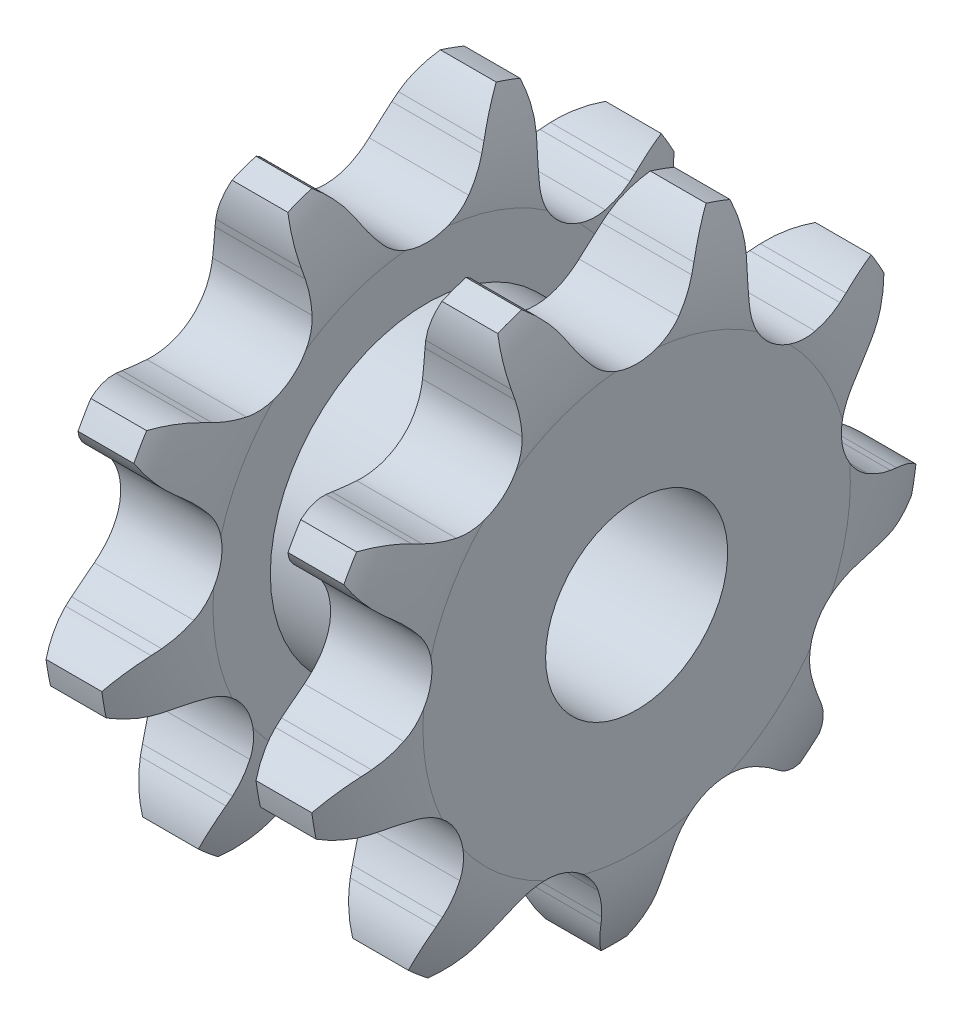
SolidWorks part; units mm, degrees
ref_plane "Plane1" through (0, 0, 0) normal (0, 0, 1) x (1, 0, 0)
ref_plane "Plane2" through (0, 0, 0) normal (0, 1, 0) x (1, 0, 0)
ref_plane "Plane3" through (0, 0, 0) normal (1, 0, 0) x (0, 0, -1)
sketch "Clipboard" plane through (0, 0, 0) normal (0, 1, 0) x (1, 0, 0)
  line L0 (0, 0) -> (25.0873, -3.9734)
  line L1 (-15, 0) -> (100, 0) construction
  line L2 (0, 0) -> (-2.1039, 2.3779)
  line L3 (0, 0) -> (-11.863, 4.5341)
  line L4 (0, 0) -> (15.6796, 2.4834)
  line L5 (0, 0) -> (-47.5972, -17.7524)
  line L6 (0, 0) -> (-35.9946, -24.2857)
  line L7 (-2.1039, 2.3779) -> (47.7628, 12.071)
  line L8 (-76.2, 38.1) -> (-47.9044, 38.1)
  line L9 (-73.2054, 38.5461) -> (-73.0531, 38.5485)
  line L10 (-73.0533, 76.1892) -> (-43.7671, 76.1892)
  circle A0 centre (0, 0) radius 7.9375
  circle A1 centre (0, 0) radius 21.812
  circle A2 centre (0, 0) radius 25.4
sketch "BasProSke" plane through (0, 0, 0) normal (0, 1, 0) x (1, 0, 0)
  line L0 (-10, 0) -> (60, 0) construction
  line L1 (0, 0) -> (0, 29.813)
  line L2 (0, 0) -> (43.4213, 0)
  line L3 (43.4213, 0) -> (43.4213, 29.813)
  line L4 (40.2463, 42.513) -> (3.175, 42.513)
  arc A0 (0, 29.813) -> (3.175, 42.513) centre (26.9875, 29.813) cw
  arc A1 (43.4213, 29.813) -> (40.2463, 42.513) centre (16.4338, 29.813) ccw
revolve "Base-Revolve" add sketch "BasProSke" angle 360 about L0
sketch "GrvSke" plane through (0, 0, 0) normal (0, 1, 0) x (1, 0, 0)
  line L0 (14.1351, 29.813) -> (14.1351, 21.812)
  line L1 (14.1351, 21.812) -> (29.2862, 21.812)
  line L2 (29.2862, 21.812) -> (29.2862, 29.813)
  line L3 (10.9601, 42.513) -> (32.4612, 42.513)
  line L4 (21.7106, 0) -> (21.7106, 52.07) construction
  line L5 (-10, 0) -> (60, 0) construction
  line L6 (0, 0) -> (35.56, 0) construction
  arc A0 (29.2862, 29.813) -> (32.4612, 42.513) centre (56.2737, 29.813) cw
  arc A1 (14.1351, 29.813) -> (10.9601, 42.513) centre (-12.8524, 29.813) ccw
revolve "Groove" cut sketch "GrvSke" angle 360 about L6
pattern_linear "Grooves" [suppressed]
sketch "TooCutSke" plane through (0, 0, 0) normal (1, 0, 0) x (0, 0, -1)
  line L0 (8.4728, 35.2524) -> (9.083, 36.3141)
  line L1 (0, 0) -> (0, 107) construction
  line L2 (0, 37.1323) -> (-10, 37.1323) construction
  line L3 (-8.4728, 35.2524) -> (-9.083, 36.3141)
  arc A0 (5.9876, 31.8038) -> (8.4728, 35.2524) centre (-9.4872, 45.5752) ccw
  arc A1 (5.9876, 31.8038) -> (-5.9876, 31.8038) centre (0, 37.1323) cw
  arc A2 (9.083, 36.3141) -> (20.8847, 43.143) centre (20.8847, 29.5309) cw
  arc A3 (-5.9876, 31.8038) -> (-8.4728, 35.2524) centre (9.4872, 45.5752) cw
  arc A4 (-9.083, 36.3141) -> (-20.8847, 43.143) centre (-20.8847, 29.5309) ccw
  arc A5 (20.8847, 43.143) -> (-20.8847, 43.143) centre (0, 0) ccw
extrude "ToothCut" cut sketch "TooCutSke" along normal through all
pattern_circular "TeethCuts" count 9 every 40 about axis through (-10, 0, 0) along (1, 0, 0) of "ToothCut"
sketch "HubNeaOneSke" plane through (0, 0, 0) normal (-1, 0, 0) x (0, 0, 1)
  circle A0 centre (0, 0) radius 21.812
extrude "HubNearOne" [suppressed] add sketch "HubNeaOneSke" along normal blind 7.3788
sketch "HubNeaBotSke" plane through (0, 0, 0) normal (-1, 0, 0) x (0, 0, 1)
  circle A0 centre (0, 0) radius 21.812
extrude "HubNearBoth" [suppressed] add sketch "HubNeaBotSke" along normal blind 3.6894
ref_plane "FarPln" through (43.4213, 0, 0) normal (1, 0, 0) x (0, 0, -1)
sketch "HubFarSke" plane through (43.4213, 0, 0) normal (1, 0, 0) x (0, 0, -1)
  circle A0 centre (0, 0) radius 21.812
extrude "HubFar" [suppressed] add sketch "HubFarSke" along normal blind 3.6894
sketch "BorSke" plane through (0, 0, 0) normal (1, 0, 0) x (0, 0, -1)
  circle A0 centre (0, 0) radius 12.7
extrude "Bore" cut sketch "BorSke" along normal mid plane 101.6001
sketch "KeySke" plane through (0, 0, 0) normal (1, 0, 0) x (0, 0, -1)
  line L0 (-3.175, 0) -> (-3.175, 15.5956)
  line L1 (-3.175, 15.5956) -> (3.175, 15.5956)
  line L2 (3.175, 15.5956) -> (3.175, 0)
  line L3 (0, 0) -> (0, 34) construction
  line L4 (-3.175, 0) -> (3.175, 0)
extrude "Keyway" [suppressed] cut sketch "KeySke" along normal mid plane 101.6001
pattern_circular "Keyway2" [suppressed] count 2 every 90 about axis through (-10, 0, 0) along (1, 0, 0)
equation "\"Num_teeth@Clipboard\" = int( \"Num_teeth@Clipboard\" )"
equation "\"Num_teeth@Clipboard\" = ((sgn( \"Num_teeth@Clipboard\" - 5.0)+1)*( \"Num_teeth@Clipboard\" - 5.0))/2 +5.0"
equation "\"Num_teeth@Clipboard\" = ((sgn( \"Num_teeth@Clipboard\" - 200.0)-1)*( \"Num_teeth@Clipboard\" - 200.0))/-2 +200.0"
equation "\"MHD@Clipboard\" = \"Pitch@Clipboard\" * (1.0 / tan(3.14159265 / \"Num_teeth@Clipboard\" ) - 1.0) - 0.03"
equation "\"Thickness@Clipboard\"  = \"Width@Clipboard\" * \"Width_factor@Clipboard\" - \"Width_const@Clipboard\" + (\"Num_strands@Clipboard\" - 1) * \"Transv_pitch@Clipboard\""
equation "\"OAL@Clipboard\" = \"Thickness@Clipboard\""
equation "\"MHD@Clipboard\" = ((sgn( \"MHD@Clipboard\" - \"Hub_dia@Clipboard\" )-1)*( \"MHD@Clipboard\" - \"Hub_dia@Clipboard\" ))/-2+ \"Hub_dia@Clipboard\""
equation "\"OAL@Clipboard\" = ((sgn( \"OAL@Clipboard\" - \"Overall_len@Clipboard\" )+1)*( \"OAL@Clipboard\" - \"Overall_len@Clipboard\" ))/2 + \"Overall_len@Clipboard\" + 0.000002"
equation "\"Num_teeth@TeethCuts\" = int( \"Show_teeth@Clipboard\" ) + 1"
equation "\"Num_teeth@TeethCuts\" = ((sgn( \"Num_teeth@TeethCuts\" - \"Num_teeth@Clipboard\" )-1)*( \"Num_teeth@TeethCuts\" - \"Num_teeth@Clipboard\" ))/-2+ \"Num_teeth@Clipboard\""
equation "\"Num_teeth@TeethCuts\" = ((sgn( \"Num_teeth@TeethCuts\" - 2.0)+1)*( \"Num_teeth@TeethCuts\" - 2.0))/2 +2.0"
equation "\"Angle@TeethCuts\" = 360.0 / \"Num_teeth@Clipboard\""
equation "\"Pitch_radius@TooCutSke\" = ( \"Pitch@Clipboard\" / 2.0) / sin(3.14159265 / \"Num_teeth@Clipboard\" )  'ma"
equation "\"R@TooCutSke\"  = \"Dr@Clipboard\" * 0.5025 + 0.0015"
equation "\"A@TooCutSke\" = 35.0 + (60.0 / \"Num_teeth@Clipboard\")"
equation "\"E@TooCutSke\"  = \"Dr@Clipboard\" * 1.3025 + 0.0015"
equation "\"B@TooCutSke\"  = 18.0 - (56.0 / \"Num_teeth@Clipboard\" )"
equation "\"W@TooCutSke\" = 1.4 * \"Dr@Clipboard\" * cos(3.14159265 / \"Num_teeth@Clipboard\" )"
equation "\"V@TooCutSke\" = 1.4 * \"Dr@Clipboard\" * sin(3.14159265 / \"Num_teeth@Clipboard\" )"
equation "\"Diameter@BasProSke\" = 2.0 * ( (0.3 * \"Pitch@Clipboard\" ) +  \"Pitch@Clipboard\" / 2.0 / tan(3.14159265 / \"Num_teeth@Clipboard\" ))"
equation "\"Thickness@BasProSke\"  = \"Thickness@Clipboard\""
equation "\"G1@BasProSke\" =  \"Chamfer_wid@Clipboard\""
equation "\"G2@BasProSke\" =  \"Chamfer_wid@Clipboard\""
equation "\"H1@BasProSke\" =  \"Chamfer_dep@Clipboard\""
equation "\"H2@BasProSke\" =  \"Chamfer_dep@Clipboard\""
equation "\"Diameter@GrvSke\" = \"Diameter@BasProSke\""
equation "\"G1@GrvSke\" = \"Chamfer_wid@Clipboard\""
equation "\"H1@GrvSke\" = \"Chamfer_dep@Clipboard\""
equation "\"Grv_diam@GrvSke\" =  \"Pitch@Clipboard\" * (1.0 / tan(3.14159265 / \"Num_teeth@Clipboard\" ) - 1.0) - 0.03"
equation "\"Grv_width@GrvSke\" =  \"Transv_pitch@Clipboard\" - ( \"Width@Clipboard\" * \"Width_factor@Clipboard\" - \"Width_const@Clipboard\" )"
equation "\"Offset@GrvSke\" = \"Grv_width@GrvSke\" / 2.0 + ( \"Width@Clipboard\" * \"Width_factor@Clipboard\" - \"Width_const@Clipboard\" )"
equation "\"Offset@Grooves\" = \"Transv_pitch@Clipboard\""
equation "\"Num_grvs@Grooves\" = \"Num_strands@Clipboard\""
equation "\"Num_grvs@Grooves\" = \"Num_grvs@Grooves\" - 1 * sgn( \"Num_grvs@Grooves\" -1)"
equation "\"Diameter@HubNeaOneSke\" = \"MHD@Clipboard\""
equation "\"Length@HubNearOne\" = \"OAL@Clipboard\" - \"Thickness@BasProSke\""
equation "\"Diameter@HubNeaBotSke\" = \"MHD@Clipboard\""
equation "\"Length@HubNearBoth\" = ( \"OAL@Clipboard\" - \"Thickness@BasProSke\" ) / 2.0"
equation "\"Thickness@FarPln\" = \"Thickness@BasProSke\""
equation "\"Diameter@HubFarSke\" = \"MHD@Clipboard\""
equation "\"Length@HubFar\" = ( \"OAL@Clipboard\" - \"Thickness@BasProSke\" ) / 2.0"
equation "\"D1@Bore\" = \"OAL@Clipboard\" * 2.0"
equation "\"D1@Keyway\" = \"OAL@Clipboard\" * 2.0"
equation "\"Offset@KeySke\" = \"T_dim@Clipboard\" - \"Diameter@BorSke\" / 2.0"
